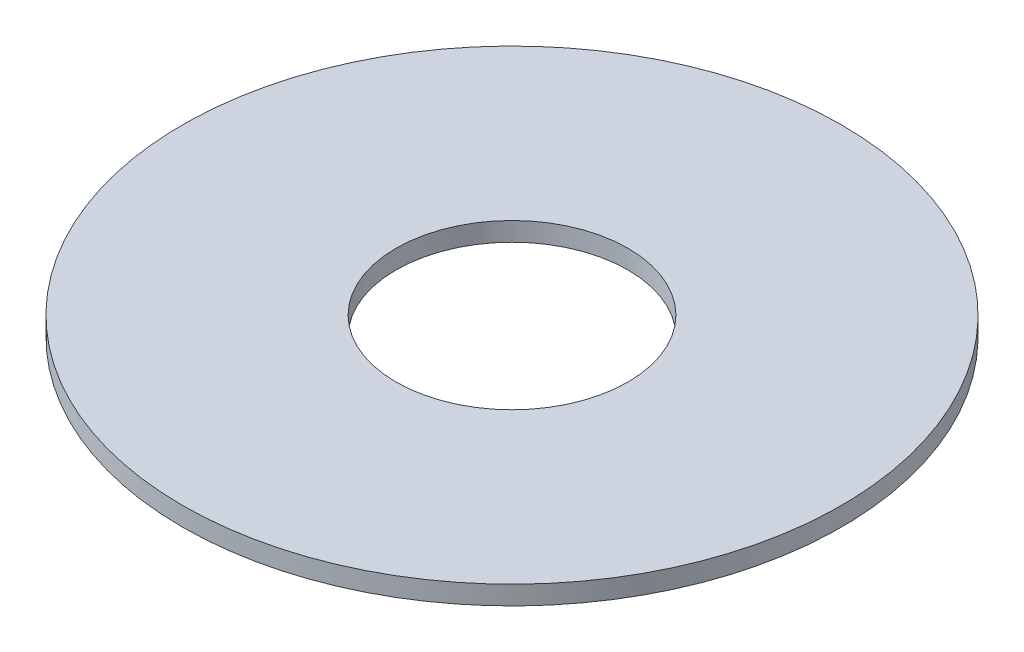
SolidWorks part; units mm, degrees
ref_plane "Front" through (0, 0, 0) normal (0, 0, 1) x (1, 0, 0)
ref_plane "Top" through (0, 0, 0) normal (0, 1, 0) x (1, 0, 0)
ref_plane "Right" through (0, 0, 0) normal (1, 0, 0) x (0, 0, -1)
sketch "Sketch1" plane through (0, 0, 0) normal (0, 1, 0) x (1, 0, 0)
  circle A0 centre (0, 0) radius 7.112
  dimension "D1" = 14.224
extrude "Extrude1" add sketch "Sketch1" along normal blind 0.4064
sketch "Sketch2" plane through (0, 0, 0) normal (0, -1, 0) x (1, 0, 0)
  circle A0 centre (0, 0) radius 2.5019
  circle A1 centre (0, 0) radius 7.112 construction
  dimension "D1" = 5.0038
extrude "Cut-Extrude1" cut sketch "Sketch2" against normal through all
